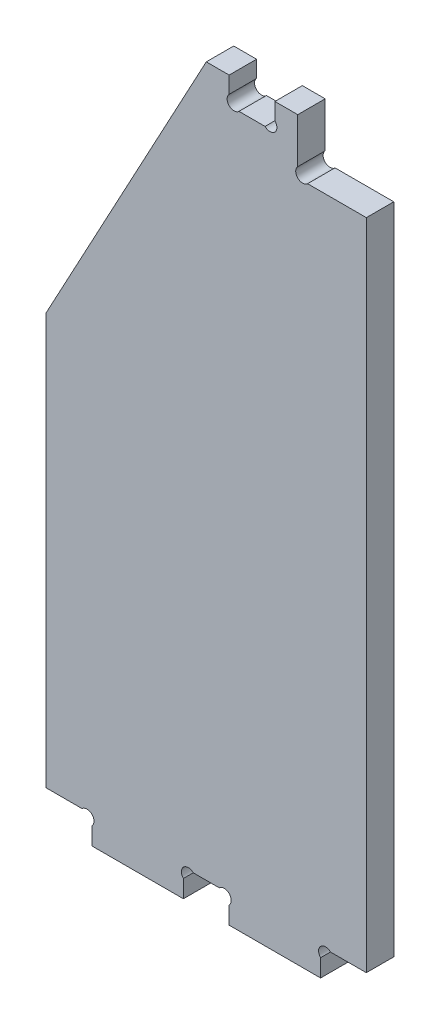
SolidWorks part; units mm, degrees
ref_plane "Plan de face" through (0, 0, 0) normal (0, 0, 1) x (1, 0, 0)
ref_plane "Plan de dessus" through (0, 0, 0) normal (0, 1, 0) x (1, 0, 0)
ref_plane "Plan de droite" through (0, 0, 0) normal (1, 0, 0) x (0, 0, -1)
sketch "Esquisse1" plane through (0, 0, 0) normal (0, 0, 1) x (1, 0, 0)
  line L0 (-17.7565, 0) -> (122.6491, 0) construction
  line L1 (0, -10) -> (0, 143.0848) construction
  line L2 (35.0089, -6) -> (7.1048, -6) construction
  line L3 (70, 160) -> (70, -11.7595) construction
  line L4 (116.1853, 143) -> (50, 143) construction
  line L5 (-12.1356, 155) -> (119.7343, 155) construction
  line L6 (-16.4316, 90) -> (50, 90) construction
  line L7 (55, 119.9235) -> (55, 160) construction
  line L8 (55, 143) -> (63.7624, 151.7624) construction
  line L9 (10, 10.3894) -> (10, -13.1799) construction
  line L10 (30, 6.6653) -> (30, -17.253) construction
  line L11 (35, -13.1799) -> (35, 8.1659) construction
  line L12 (20, 10.3894) -> (20, -12.297) construction
  line L13 (10, 0) -> (4.9492, -5.0508) construction
  line L14 (0, 0) -> (7.8504, 0)
  line L15 (40, -6) -> (40, -2.1496)
  line L16 (10, -2.1496) -> (10, -6)
  line L17 (10, -6) -> (30, -6)
  line L18 (30, -6) -> (30, -2.1496)
  line L19 (60, -6) -> (40, -6)
  line L20 (32.1496, 0) -> (37.8504, 0)
  line L21 (60, -2.1496) -> (60, -6)
  line L22 (70, 0) -> (62.1496, 0)
  line L23 (35, 155) -> (40, 155)
  line L24 (55, 155) -> (55, 145.1496)
  line L25 (35, 165.5164) -> (35, 125.0105) construction
  line L26 (57.1496, 143) -> (70, 143)
  line L27 (35, 155) -> (0, 90)
  line L28 (0, 90) -> (0, 0)
  line L29 (70, 143) -> (70, 0)
  line L30 (40, 158.2113) -> (40, 148.9057) construction
  line L31 (37.3368, 149.2) -> (51.8122, 149.2) construction
  line L32 (50, 148.9057) -> (50, 157.4206) construction
  line L33 (45, 156.9504) -> (45, 152.5338) construction
  line L34 (40, 149.2) -> (42.2124, 151.4124) construction
  line L35 (40, 155) -> (40, 151.3496)
  line L37 (42.1496, 149.2) -> (47.8504, 149.2)
  line L39 (50, 151.3496) -> (50, 155)
  line L40 (50, 155) -> (55, 155)
  arc A0 (10, -2.1496) -> (7.8504, 0) centre (8.9252, -1.0748) ccw
  arc A1 (30, -2.1496) -> (32.1496, 0) centre (31.0748, -1.0748) cw
  arc A2 (40, -2.1496) -> (37.8504, 0) centre (38.9252, -1.0748) ccw
  arc A3 (60, -2.1496) -> (62.1496, 0) centre (61.0748, -1.0748) cw
  arc A4 (55, 145.1496) -> (57.1496, 143) centre (56.0748, 144.0748) ccw
  arc A5 (40, 151.3496) -> (42.1496, 149.2) centre (41.0748, 150.2748) ccw
  arc A6 (50, 151.3496) -> (47.8504, 149.2) centre (48.9252, 150.2748) cw
  dimension "D3" = 45
  dimension "D1" = 45
  dimension "D2" = 45
extrude "Extrusion1" add sketch "Esquisse1" along normal blind 6
